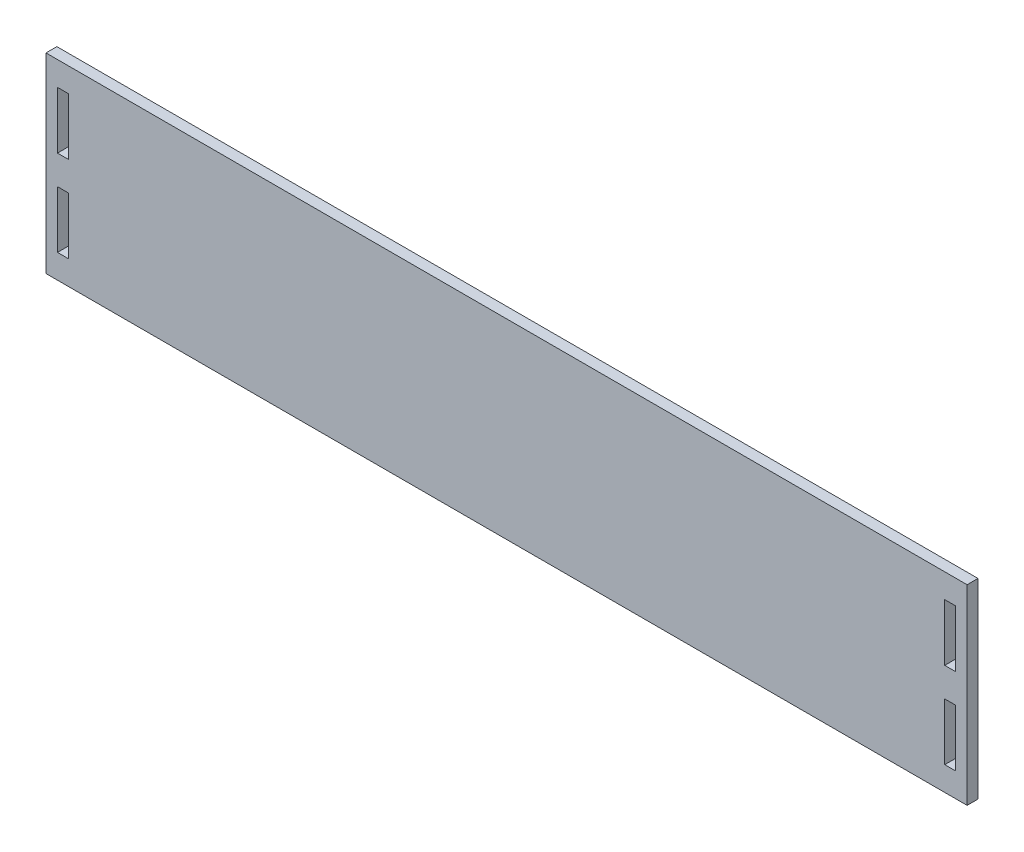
SolidWorks part; units mm, degrees
ref_plane "Alzado" through (0, 0, 0) normal (0, 0, 1) x (1, 0, 0)
ref_plane "Planta" through (0, 0, 0) normal (0, 1, 0) x (1, 0, 0)
ref_plane "Vista lateral" through (0, 0, 0) normal (1, 0, 0) x (0, 0, -1)
sketch "Croquis1" plane through (0, 0, 0) normal (0, 0, 1) x (1, 0, 0)
  line L1 (-241, -50) -> (241, -50)
  line L2 (-241, -50) -> (-241, 50)
  line L3 (-241, 50) -> (241, 50)
  line L4 (241, -50) -> (241, 50)
  line L5 (-241, -50) -> (241, 50) construction
  line L6 (-241, 50) -> (241, -50) construction
  point P0 (0, 0)
  dimension "D1" = 100
  dimension "D2" = 482
extrude "Saliente-Extruir1" add sketch "Croquis1" along normal blind 5.7
sketch "Croquis2" plane through (0, 0, 5.7) normal (0, 0, 1) x (1, 0, 0)
  line L0 (-241, 50) -> (-241, -50) construction
  line L1 (-229.3, 37.4) -> (-235, 37.4)
  line L2 (-229.3, 37.4) -> (-229.3, 7.6)
  line L3 (-229.3, 7.6) -> (-235, 7.6)
  line L4 (-235, 37.4) -> (-235, 7.6)
  line L5 (-229.3, -7.6) -> (-235, -7.6)
  line L6 (-229.3, -7.6) -> (-229.3, -37.4)
  line L7 (-229.3, -37.4) -> (-235, -37.4)
  line L8 (-235, -7.6) -> (-235, -37.4)
  line L9 (0, 50) -> (0, -50) construction
  line L10 (241, 50) -> (-241, 50) construction
  line L11 (-241, -50) -> (241, -50) construction
  line L12 (235, -7.6) -> (235, -37.4)
  line L13 (229.3, -37.4) -> (235, -37.4)
  line L14 (229.3, -7.6) -> (229.3, -37.4)
  line L15 (229.3, -7.6) -> (235, -7.6)
  line L16 (235, 37.4) -> (235, 7.6)
  line L17 (-235, 7.6) -> (-235, -7.6) construction
  line L18 (229.3, 7.6) -> (235, 7.6)
  line L19 (229.3, 37.4) -> (229.3, 7.6)
  line L20 (229.3, 37.4) -> (235, 37.4)
  point P18 (-241, 0)
  point P19 (-235, 0)
  point P20 (-235, 22.5)
  point P21 (-235, -22.5)
  dimension "D1" = 6
  dimension "D2" = 5.7
  dimension "D3" = 29.8
  dimension "D4" = 29.8
  dimension "D5" = 45
extrude "Cortar-Extruir1" cut sketch "Croquis2" against normal up to next
